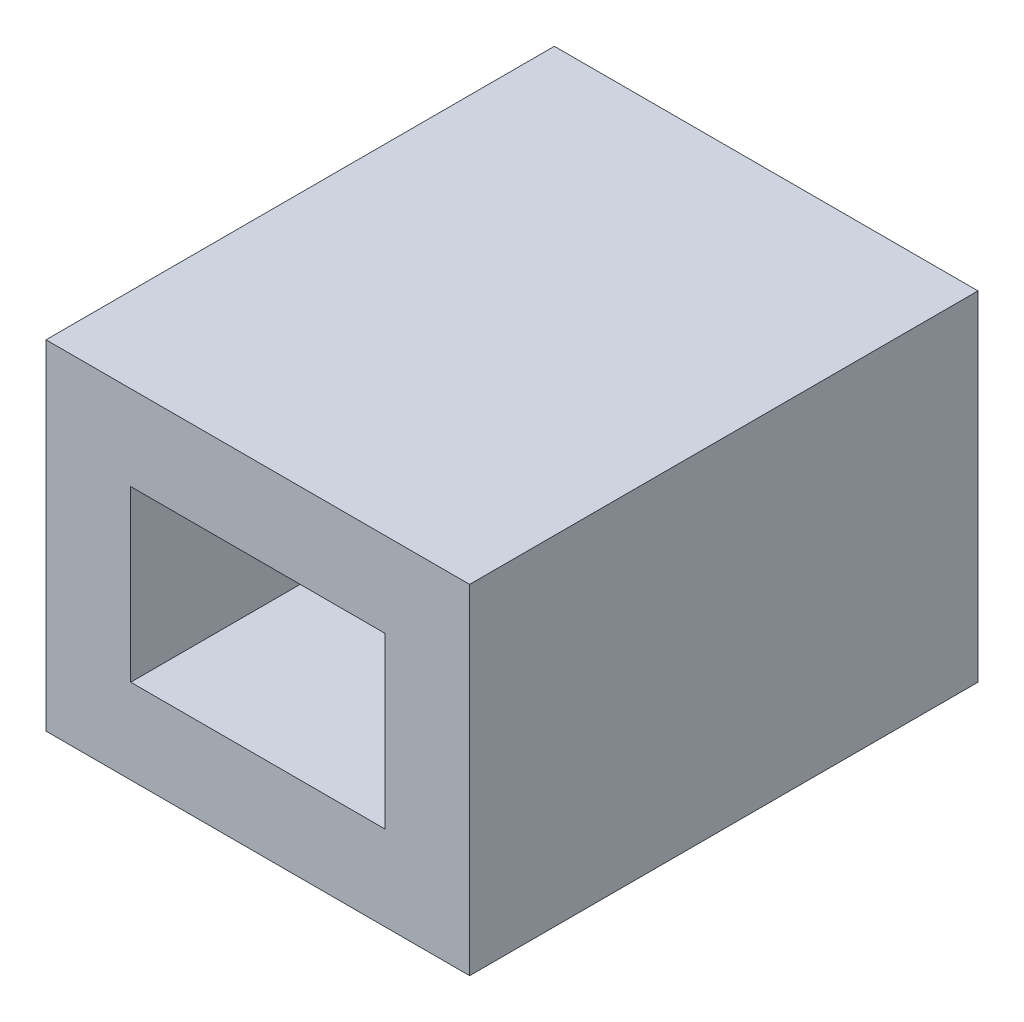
SolidWorks part; units mm, degrees
ref_plane "Front Plane" through (0, 0, 0) normal (0, 0, 1) x (1, 0, 0)
ref_plane "Top Plane" through (0, 0, 0) normal (0, 1, 0) x (1, 0, 0)
ref_plane "Right Plane" through (0, 0, 0) normal (1, 0, 0) x (0, 0, -1)
sketch "Sketch1" plane through (0, 0, 0) normal (0, 0, 1) x (1, 0, 0)
  line L1 (-38.527, 16.361) -> (24.973, 16.361)
  line L2 (-38.527, 16.361) -> (-38.527, -34.439)
  line L3 (-38.527, -34.439) -> (24.973, -34.439)
  line L4 (24.973, 16.361) -> (24.973, -34.439)
  line L5 (-25.827, 3.661) -> (12.273, 3.661)
  line L6 (-25.827, 3.661) -> (-25.827, -21.739)
  line L7 (-25.827, -21.739) -> (12.273, -21.739)
  line L8 (12.273, 3.661) -> (12.273, -21.739)
  dimension "D1" = 25.4
  dimension "D2" = 38.1
  dimension "D3" = 12.7
  dimension "D4" = 12.7
  dimension "D5" = 12.7
  dimension "D6" = 12.7
extrude "Extrude1" add sketch "Sketch1" along normal blind 76.2
